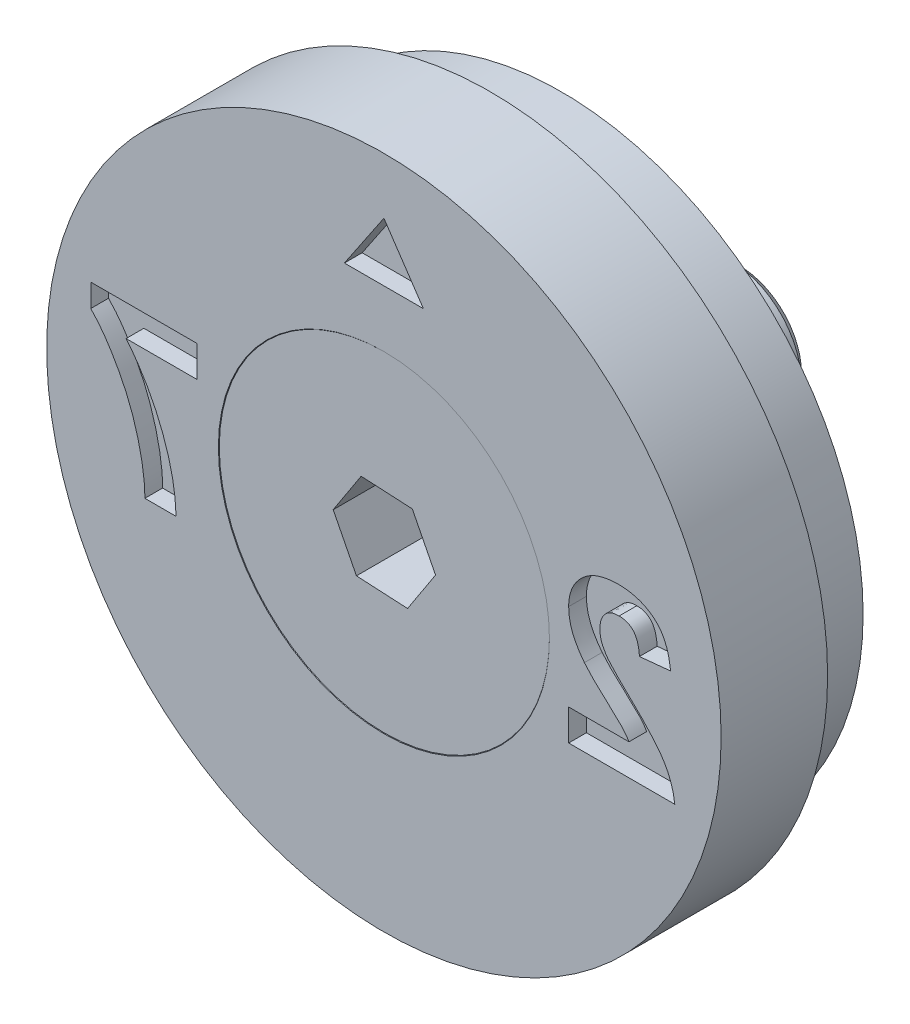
SolidWorks part; units mm, degrees
other "<M4 X .7 FHCS>-<Imported1>"
ref_plane "Front Plane" through (0, 0, 0) normal (0, 0, 1) x (1, 0, 0)
ref_plane "Top Plane" through (0, 0, 0) normal (0, 1, 0) x (1, 0, 0)
ref_plane "Right Plane" through (0, 0, 0) normal (1, 0, 0) x (0, 0, -1)
imported_body "Imported1"
sketch "Sketch1" plane through (0, 0, 0) normal (0, 0, 1) x (1, 0, 0)
  text T0 "2       7" font "Arial" height 4.572
  dimension "D1" = 2.286
extrude "Cut-Extrude1" cut sketch "Sketch1" against normal blind 0.5
inserted part "M4 X .7 FHCS"
move or copy body "Body-Move/Copy2" placed by mates yes
